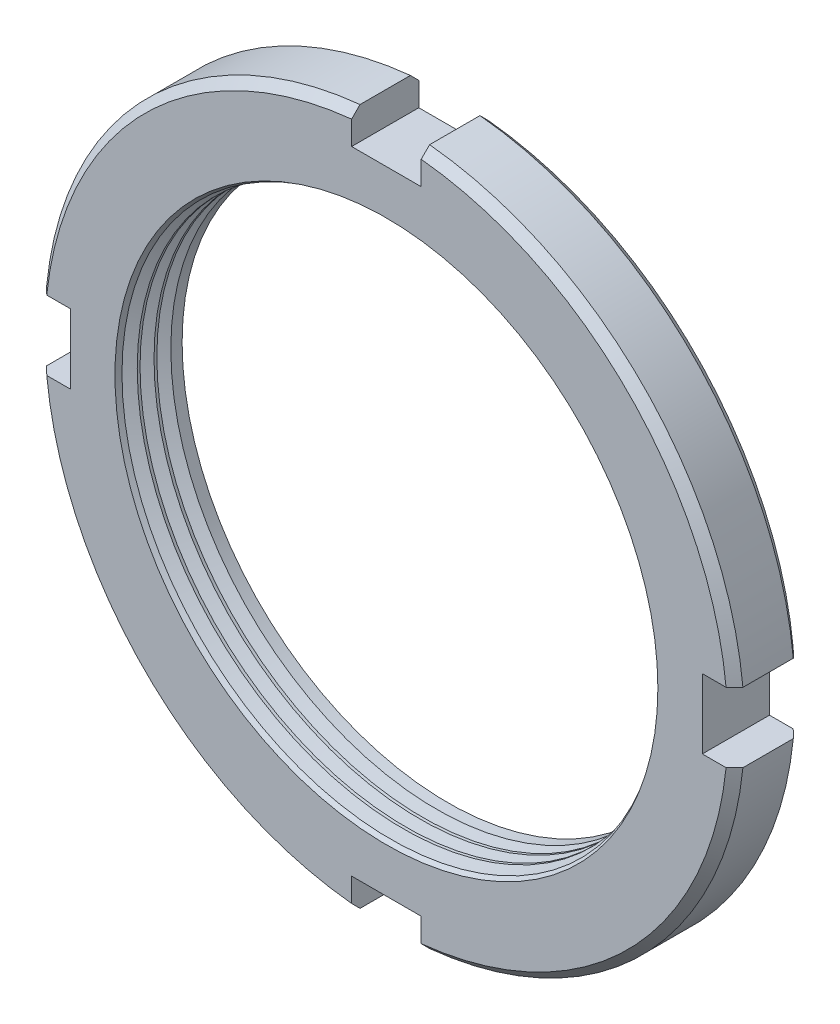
SolidWorks part; units mm, degrees
ref_plane "Front" through (0, 0, 0) normal (0, 0, 1) x (1, 0, 0)
ref_plane "Top" through (0, 0, 0) normal (0, 1, 0) x (1, 0, 0)
ref_plane "Right" through (0, 0, 0) normal (1, 0, 0) x (0, 0, -1)
other "Configuration Table"
sketch "Sketch2" plane through (0, 0, 0) normal (0, 0, 1) x (1, 0, 0)
  circle A0 centre (0, 0) radius 62.5
  dimension "dk" = 125
extrude "BaseNut" add sketch "Sketch2" against normal blind 12
chamfer "Chamfer1" distance 1.5 angle 45 2 edges at (62.5, 0, -12) (62.5, 0, 0)
sketch "Sketch3" plane through (-17.5617, 31.6827, 0) normal (0, 0, 1) x (1, 0, 0)
  circle A0 centre (17.5617, -31.6827) radius 47.5
  circle A1 centre (17.5617, -31.6827) radius 61 construction
extrude "Hole" cut sketch "Sketch3" against normal through all
chamfer "EndChamfer" distance 1 angle 60 2 edges at (47.5, 0, 0) (47.5, 0, -12)
sketch "Sketch4" plane through (-28.8484, 49.2663, 0) normal (0, 0, 1) x (1, 0, 0)
  line L0 (28.8484, 68.6571) -> (28.8484, -68.9081) construction
  line L2 (22.6334, 12.9239) -> (35.0634, 12.9239) construction
  line L3 (22.6334, 12.9239) -> (22.6334, 7.1739)
  line L4 (22.6334, 7.1739) -> (35.0634, 7.1739)
  line L5 (35.0634, 12.9239) -> (35.0634, 7.1739)
  arc A1 (35.0634, 12.9239) -> (22.6334, 12.9239) centre (28.8484, -49.2663) ccw
  circle A2 centre (28.8484, -49.2663) radius 62.5 construction
  dimension "n" = 12.43
  dimension "t" = 5.75
extrude "SlotCut" cut sketch "Sketch4" against normal through all
pattern_circular "SlotPat" count 4 over 360 about axis through (0, 0, 0) along (0, 0, 1) of "SlotCut"
sketch "Sketch5" plane through (0, 0, 0) normal (0, 1, 0) x (1, 0, 0)
  line L0 (45, 2.9821) -> (45, 0.4821)
  line L1 (45, 0.4821) -> (47.5, 0.4821)
  line L2 (47.5, 0.4821) -> (49.6651, 1.7321)
  line L3 (49.6651, 1.7321) -> (47.5, 2.9821)
  line L4 (47.5, 2.9821) -> (45, 2.9821)
  line L5 (0, 37.3018) -> (0, -33.5096) construction
  line L9 (47.5, 1.7321) -> (-47.5, 1.7321) construction
revolve "Cut-Revolve10" cut sketch "Sketch5" angle 360 about L5
pattern_linear "LPattern10" count 3 spacing 3 along (0, 0, -1) of "Cut-Revolve10"
equation "\"D1@Sketch5\" =  ( \"D2@ThreadCosmetic1\" - \"D1@Sketch3\" )  / 2"
equation "\"D3@LPattern10\" = \"D1@Sketch5\" * 1.2"
equation "\"D1@LPattern10\" = \"m@BaseNut\" / \"D3@LPattern10\"-1"
equation "\"D2@Sketch5\" = \"D1@Sketch3\""
